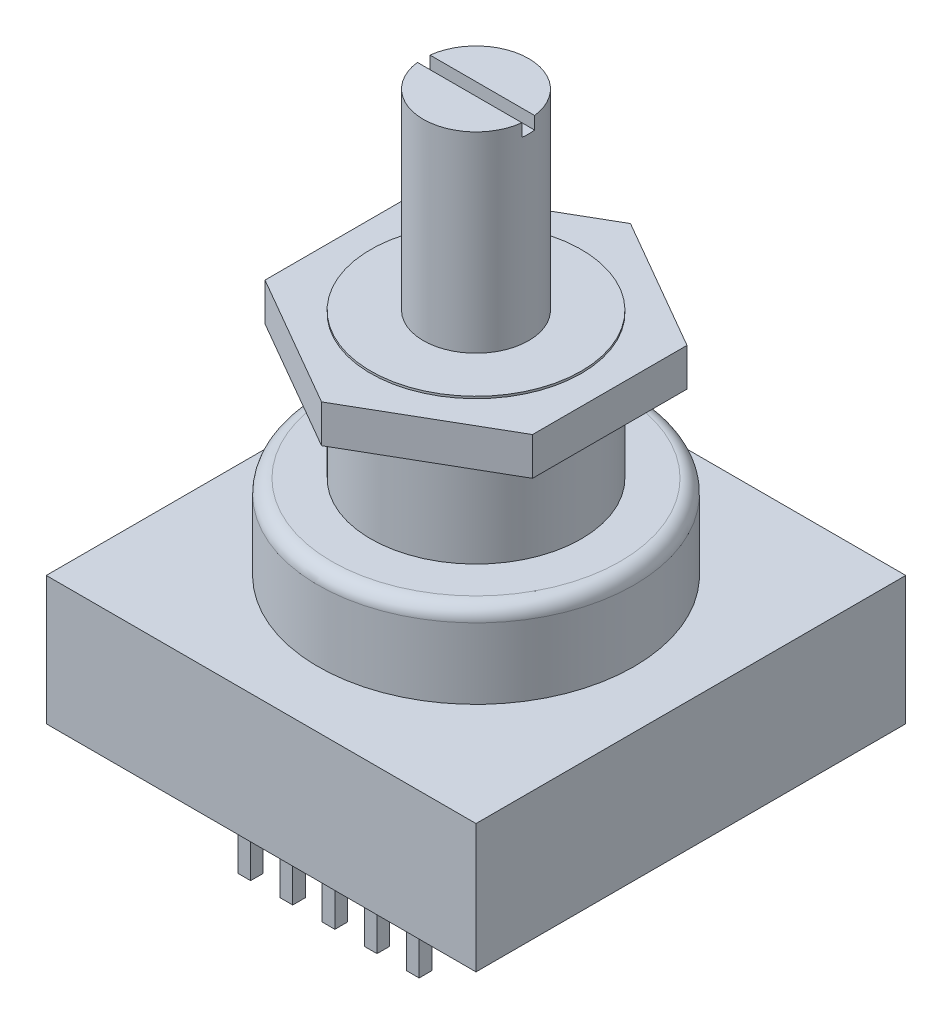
SolidWorks part; units mm, degrees
ref_plane "Front Plane" through (0, 0, 0) normal (0, 0, 1) x (1, 0, 0)
ref_plane "Top Plane" through (0, 0, 0) normal (0, 1, 0) x (1, 0, 0)
ref_plane "Right Plane" through (0, 0, 0) normal (1, 0, 0) x (0, 0, -1)
sketch "Sketch1" plane through (0, 0, 0) normal (0, 1, 0) x (1, 0, 0)
  line L0 (12.954, 12.954) -> (-12.954, -12.954) construction
  line L1 (-12.954, 12.954) -> (12.954, 12.954)
  line L2 (-12.954, 12.954) -> (-12.954, -12.954)
  line L3 (-12.954, -12.954) -> (12.954, -12.954)
  line L4 (12.954, 12.954) -> (12.954, -12.954)
  point P4 (0, 0)
  dimension "D1" = 25.908
  dimension "D2" = 25.908
extrude "Extrude1" add sketch "Sketch1" along normal blind 7.747
sketch "Sketch2" plane through (0, 0, 0) normal (0, -1, 0) x (1, 0, 0)
  line L0 (-12.954, 12.954) -> (12.954, 12.954) construction
  line L1 (-0.381, 8.89) -> (0.381, 8.89)
  line L2 (-0.381, 8.89) -> (-0.381, 8.128)
  line L3 (-0.381, 8.128) -> (0.381, 8.128)
  line L4 (0.381, 8.89) -> (0.381, 8.128)
  line L5 (2.159, 8.89) -> (2.159, 8.128)
  line L6 (2.159, 8.89) -> (2.921, 8.89)
  line L7 (2.921, 8.89) -> (2.921, 8.128)
  line L8 (2.159, 8.128) -> (2.921, 8.128)
  line L9 (4.699, 8.89) -> (4.699, 8.128)
  line L10 (4.699, 8.89) -> (5.461, 8.89)
  line L11 (5.461, 8.89) -> (5.461, 8.128)
  line L12 (4.699, 8.128) -> (5.461, 8.128)
  line L13 (-2.921, 8.128) -> (-2.159, 8.128)
  line L14 (-2.921, 8.89) -> (-2.921, 8.128)
  line L15 (-2.921, 8.89) -> (-2.159, 8.89)
  line L16 (-2.159, 8.89) -> (-2.159, 8.128)
  line L17 (-5.461, 8.128) -> (-4.699, 8.128)
  line L18 (-5.461, 8.89) -> (-5.461, 8.128)
  line L19 (-5.461, 8.89) -> (-4.699, 8.89)
  line L20 (-4.699, 8.89) -> (-4.699, 8.128)
  point P4 (0, 8.128)
  dimension "D1" = 0.762
  dimension "D2" = 0.762
  dimension "D3" = 4.826
extrude "Extrude3" add sketch "Sketch2" along normal blind 6.096 separate body
sketch "Sketch4" plane through (0, 0, 0) normal (0, 0, 1) x (1, 0, 0)
  line L0 (0, 7.747) -> (0, 33.147) construction
  line L1 (-12.954, 7.747) -> (12.954, 7.747) construction
  line L2 (0, 33.147) -> (3.175, 33.147)
  line L3 (3.175, 33.147) -> (3.175, 21.59)
  line L4 (3.175, 21.59) -> (6.35, 21.59)
  line L5 (6.35, 21.59) -> (6.35, 12.827)
  line L6 (6.35, 12.827) -> (8.6995, 12.827)
  line L7 (9.525, 12.0015) -> (9.525, 7.747)
  arc A0 (8.6995, 12.827) -> (9.525, 12.0015) centre (8.6995, 12.0015) cw
  point P13 (9.525, 12.827)
  dimension "D7" = 0.8255
  dimension "D1" = 25.4
  dimension "D2" = 19.05
  dimension "D3" = 5.08
  dimension "D4" = 12.7
  dimension "D5" = 6.35
  dimension "D6" = 8.763
revolve "Revolve-Thin1" add sketch "Sketch4" angle 360 about L0
ref_plane "Plane1" through (0, 19.177, 0) normal (0, 1, 0) x (-1, 0, 0)
sketch "Sketch5" plane through (0, 19.177, 0) normal (0, 1, 0) x (-1, 0, 0)
  line L1 (0, 9.3121) -> (-8.0645, 4.656)
  line L2 (-8.0645, 4.656) -> (-8.0645, -4.656)
  line L3 (-8.0645, -4.656) -> (0, -9.3121)
  line L4 (0, -9.3121) -> (8.0645, -4.656)
  line L5 (8.0645, -4.656) -> (8.0645, 4.656)
  line L6 (8.0645, 4.656) -> (0, 9.3121)
  circle A0 centre (0, 0) radius 8.0645 construction
  dimension "D1" = 16.129
extrude "Extrude4" add sketch "Sketch5" along normal blind 2.286 separate body
sketch "Sketch6" plane through (0, 33.147, 0) normal (0, 1, 0) x (1, 0, 0)
  line L1 (-4.13, 0.381) -> (4.7236, 0.381)
  line L2 (-4.13, 0.381) -> (-4.13, -0.381)
  line L3 (-4.13, -0.381) -> (4.7236, -0.381)
  line L4 (4.7236, 0.381) -> (4.7236, -0.381)
  point P4 (4.7236, 0)
  dimension "D1" = 0.762
extrude "Cut-Extrude1" cut sketch "Sketch6" against normal blind 0.762
